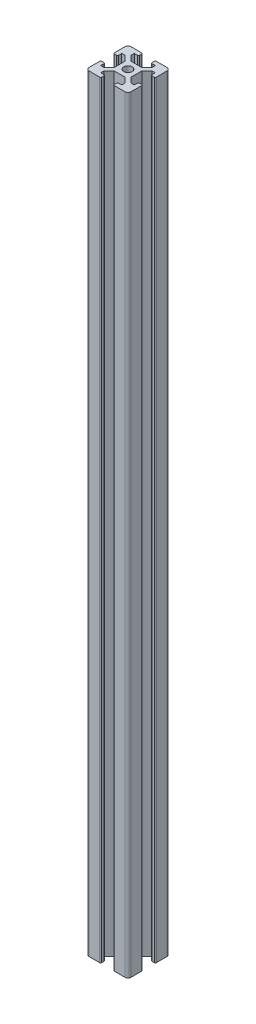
SolidWorks part; units mm, degrees
ref_plane "Alzado" through (0, 0, 0) normal (0, 0, 1) x (1, 0, 0)
ref_plane "Planta" through (0, 0, 0) normal (0, 1, 0) x (1, 0, 0)
ref_plane "Vista lateral" through (0, 0, 0) normal (1, 0, 0) x (0, 0, -1)
sketch "Croquis1" plane through (0, 0, 0) normal (0, 1, 0) x (1, 0, 0)
  line L0 (-10, 10) -> (-3, 10)
  line L1 (-2.5858, -4) -> (2.5858, -4)
  line L2 (-4, -2.5858) -> (-4, 2.5858)
  line L3 (-2.5858, 4) -> (2.5858, 4)
  line L4 (4, -2.5858) -> (4, 2.5858)
  line L5 (-4, -4) -> (4, 4) construction
  line L6 (-1.4142, 1.4142) -> (4, -4) construction
  line L11 (-10, -10) -> (10, 10) construction
  line L12 (5, 8) -> (5, 6.4142)
  line L13 (-3, 10) -> (-3, 8)
  line L20 (-8, 5) -> (-6.4142, 5)
  line L21 (-5, 8) -> (-5, 6.4142)
  line L30 (-3, 8) -> (-5, 8)
  line L31 (-10, 3) -> (-8, 3)
  line L32 (-8, 3) -> (-8, 5)
  line L33 (0, 14.0655) -> (0, -11.7776) construction
  line L34 (-14.7196, 0) -> (20.6254, 0) construction
  line L35 (-2.5858, 4) -> (-5, 6.4142)
  line L36 (-4, 2.5858) -> (-6.4142, 5)
  line L37 (3, 8) -> (5, 8)
  line L38 (3, 10) -> (3, 8)
  line L39 (10, 3) -> (8, 3)
  line L40 (-1.4142, 1.4142) -> (10, -10) construction
  line L41 (8, 3) -> (8, 5)
  line L42 (8, 5) -> (6.4142, 5)
  line L43 (4, 2.5858) -> (6.4142, 5)
  line L44 (2.5858, 4) -> (5, 6.4142)
  line L45 (10, -3) -> (8, -3)
  line L46 (8, -3) -> (8, -5)
  line L47 (8, -5) -> (6.4142, -5)
  line L48 (4, -2.5858) -> (6.4142, -5)
  line L49 (5, -8) -> (5, -6.4142)
  line L50 (2.5858, -4) -> (5, -6.4142)
  line L51 (3, -8) -> (5, -8)
  line L52 (3, -10) -> (3, -8)
  line L53 (-3, -10) -> (-3, -8)
  line L54 (-3, -8) -> (-5, -8)
  line L55 (-10, -3) -> (-8, -3)
  line L56 (-8, -3) -> (-8, -5)
  line L57 (-8, -5) -> (-6.4142, -5)
  line L58 (-4, -2.5858) -> (-6.4142, -5)
  line L59 (-2.5858, -4) -> (-5, -6.4142)
  line L60 (-5, -8) -> (-5, -6.4142)
  line L63 (-10, -3) -> (-10, -10)
  line L66 (3, 10) -> (10, 10)
  line L67 (-10, 10) -> (-10, 3)
  line L68 (10, 10) -> (10, 3)
  line L69 (-10, -10) -> (-3, -10)
  line L70 (3, -10) -> (10, -10)
  line L71 (10, -10) -> (10, -3)
  circle A0 centre (0, 0) radius 2
  point P0 (0, 0)
  dimension "D3" = 4
  dimension "D2" = 8
  dimension "D4" = 20
  dimension "D5" = 20
  dimension "D14" = 2
  dimension "D16" = 2
extrude "Saliente-Extruir1" add sketch "Croquis1" along normal blind 365
fillet "Redondeo1" radius 1.5 4 edges at (10, 182.5, 10) (-10, 182.5, 10) (-10, 182.5, -10) (10, 182.5, -10)
fillet "Redondeo2" radius 0.5 16 edges at (3, 182.5, 10) (3, 182.5, 8) (-3, 182.5, 10) (-3, 182.5, 8) (-10, 182.5, 3) (-8, 182.5, 3) (10, 182.5, 3) (8, 182.5, 3) (-10, 182.5, -3) (-8, 182.5, -3) (-3, 182.5, -8) (3, 182.5, -8) (8, 182.5, -3) (10, 182.5, -3) (3, 182.5, -10) (-3, 182.5, -10)
